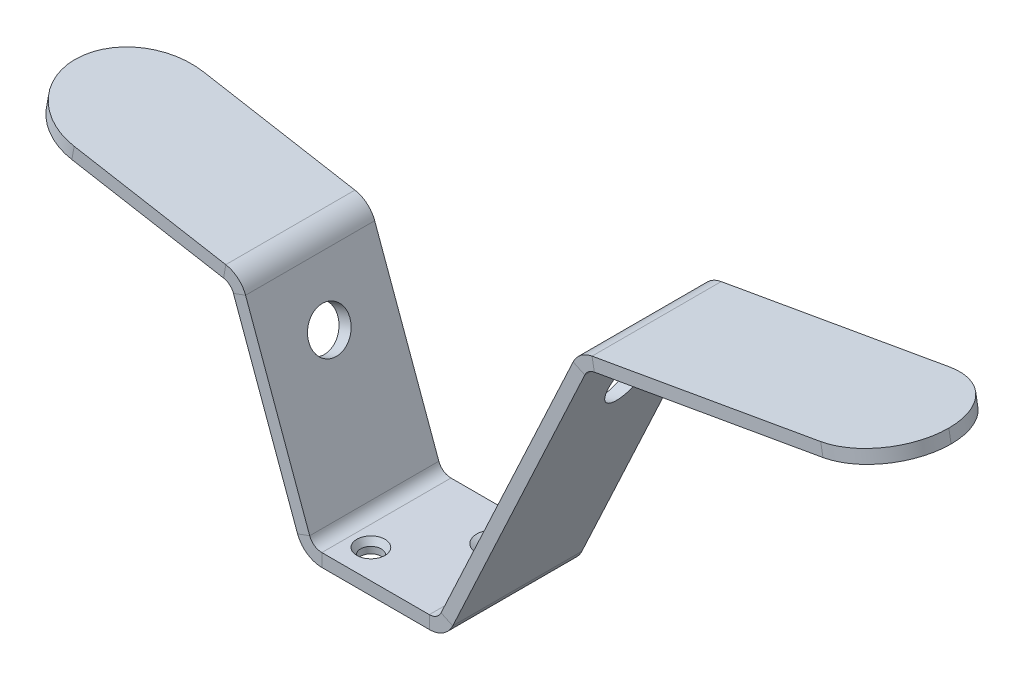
SolidWorks part; units mm, degrees
ref_plane "Plan1" through (0, 0, 0) normal (0, 0, 1) x (1, 0, 0)
ref_plane "Plan2" through (0, 0, 0) normal (0, 1, 0) x (1, 0, 0)
ref_plane "Plan3" through (0, 0, 0) normal (1, 0, 0) x (0, 0, -1)
sketch "Esquisse1" plane through (0, 0, 0) normal (0, 0, 1) x (1, 0, 0)
  line L0 (68.2621, 55.2895) -> (21.9761, 47.128)
  line L1 (21.9761, 47.128) -> (0, 0)
  line L2 (0, 0) -> (-22, 0)
  line L3 (-22, 0) -> (-33.2867, 31.0099)
  line L4 (-33.2867, 31.0099) -> (-67.7549, 37.0875)
  dimension "D1" = 35
  dimension "D2" = 33
  dimension "D3" = 22
  dimension "D4" = 52
  dimension "D5" = 47
  dimension "D6" = 120
  dimension "D7" = 110
  dimension "D8" = 115
  dimension "D9" = 125
extrude "Extru.-Mince1" add sketch "Esquisse1" along normal blind 20 thin
fillet "Congé1" radius 10 8 edges at (-67.5813, 38.0724, 0) (67.9148, 57.2591, 10) (68.2621, 55.2895, 10) (-67.7549, 37.0875, 10) (-67.4076, 39.0572, 10) (68.0885, 56.2743, 20) (-67.5813, 38.0724, 20) (68.0885, 56.2743, 0)
sketch "Esquisse2" plane through (0, 2, 0) normal (0, 1, 0) x (-1, 0, 0)
  line L0 (20.5996, 20) -> (20.5996, 0) construction
  line L1 (1.2741, 20) -> (20.5996, 20) construction
  line L2 (0, 20) -> (22, 20) construction
  circle A0 centre (16.0996, 15.5) radius 1.6
  circle A1 centre (7.0996, 5.5) radius 1.6
  dimension "D5" = 3.2
  dimension "D1" = 4.5
  dimension "D2" = 9
  dimension "D3" = 4.5
  dimension "D4" = 10
extrude "Enlèv. mat.-Extru.1" cut sketch "Esquisse2" against normal through all
sketch "Esquisse3" plane through (-17.5471, -6.3866, 0) normal (0.9397, 0.342, 0) x (0, 0, -1)
  line L0 (-20, 8.9249) -> (-20, 41.6791) construction
  line L1 (-20, 41.6791) -> (0, 41.6791) construction
  circle A0 centre (-10, 30.6791) radius 3.2
  dimension "D1" = 6.4
  dimension "D2" = 10
  dimension "D3" = 11
extrude "Enlèv. mat.-Extru.2" cut sketch "Esquisse3" against normal mid plane 120
sheet metal parameters "Tôlerie 1" parameters "D1"=2
bend "Pli dans angle2" parameters "D1"=0
flatten bends "Dépliage 1"
sketch "Esquisse-Angle1" plane through (0, 2, 0) normal (0, 1, 0) x (-1, 0, 0)
  line L0 (0.8466, 20) -> (0.8466, 0) construction
  line L1 (-50.7056, 0) -> (-50.7056, 20) construction
  line L2 (21.0318, 0) -> (21.0318, 20) construction
  line L3 (53.4796, 20) -> (53.4796, 0) construction
bend "Pli dans angle1" bend angle 70 parameters "D1"=0, "D5"=3
bend "Pli dans angle3" bend angle 55 parameters "D1"=0, "D5"=2
bend "Pli dans angle4" bend angle 60 parameters "D1"=0, "D5"=4
process bends "Pliage 1" parameters "D1"=0
sketch "Esquisse-Plate1" plane through (0, 2, 0) normal (0, 1, 0) x (-1, 0, 0)
chamfer "Chanfrein1" distance 1 angle 30 2 edges at (-17.6996, 2, 15.5) (-8.6996, 2, 5.5)
